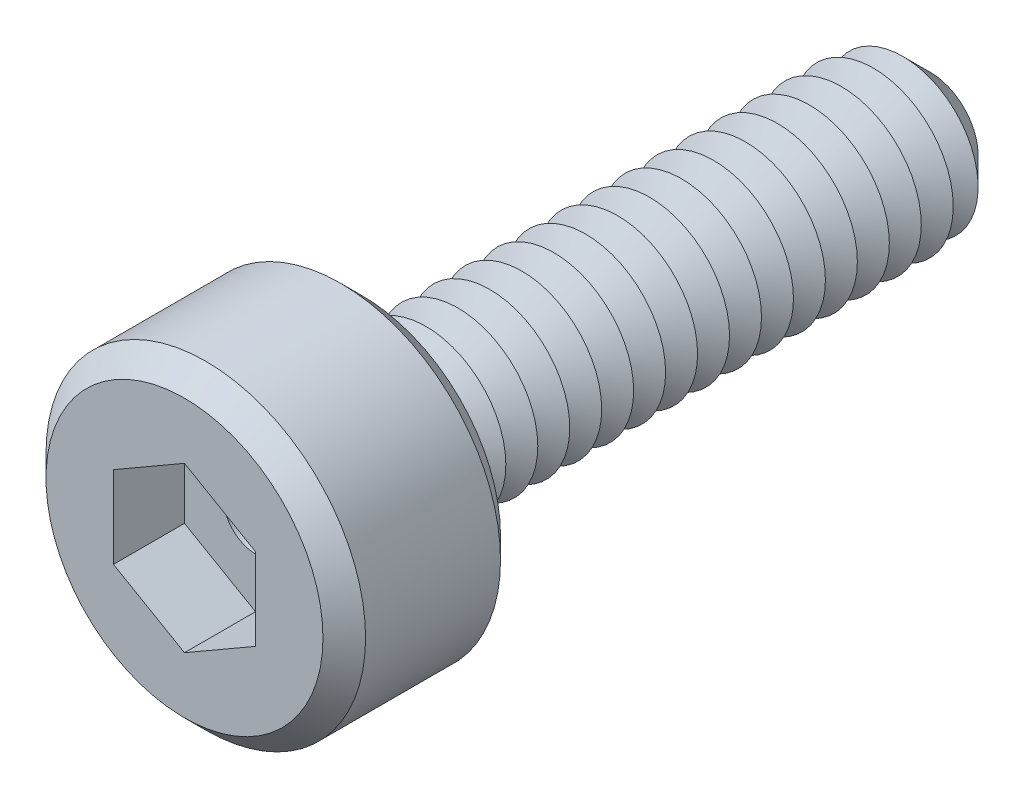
SolidWorks part; units mm, degrees
ref_plane "Front Plane" through (0, 0, 0) normal (0, 0, 1) x (1, 0, 0)
ref_plane "Top Plane" through (0, 0, 0) normal (0, 1, 0) x (1, 0, 0)
ref_plane "Right Plane" through (0, 0, 0) normal (1, 0, 0) x (0, 0, -1)
sketch "Sketch1" plane through (0, 0, 0) normal (0, 0, 1) x (1, 0, 0)
  circle A0 centre (0, 0) radius 2.25
  dimension "D1" = 4.5
extrude "Boss-Extrude1" add sketch "Sketch1" along normal blind 2.5
sketch "Sketch2" plane through (0, 0, 0) normal (0, 0, -1) x (-1, 0, 0)
  circle A0 centre (0, 0) radius 1.125
  dimension "D1" = 2.25
extrude "Boss-Extrude2" add sketch "Sketch2" along normal blind 8
chamfer "Chamfer1" distance 0.45 angle 45 1 edges at (-1.125, 0, -8)
sketch "Sketch3" plane through (0, 0, 0) normal (1, 0, 0) x (0, 0, -1)
  line L0 (-2.5121, 0) -> (4.5776, 0) construction
sketch "Sketch4" plane through (0, 0, 0) normal (1, 0, 0) x (0, 0, -1)
  line L0 (0, 1.125) -> (0.225, 0.7353)
  line L1 (0.225, 0.7353) -> (0.45, 1.125)
  line L2 (7.55, 1.125) -> (0, 1.125) construction
  line L3 (0.45, 1.125) -> (0, 1.125)
  dimension "D1" = 0.45
revolve "Cut-Revolve1" cut sketch "Sketch4" angle 360 about L0
pattern_linear "LPattern1" count 17 spacing 0.45 along (0, 0, -1) of "Cut-Revolve1"
sketch "Sketch5" plane through (0, 0, 2.5) normal (0, 0, 1) x (1, 0, 0)
  line L1 (0, 1.1547) -> (-1, 0.5774)
  line L2 (-1, 0.5774) -> (-1, -0.5774)
  line L3 (-1, -0.5774) -> (0, -1.1547)
  line L4 (0, -1.1547) -> (1, -0.5774)
  line L5 (1, -0.5774) -> (1, 0.5774)
  line L6 (1, 0.5774) -> (0, 1.1547)
  circle A0 centre (0, 0) radius 1 construction
  dimension "D1" = 2
extrude "Cut-Extrude1" cut sketch "Sketch5" against normal blind 1
sketch "Sketch6" plane through (0, 0, 1.5) normal (0, 0, 1) x (1, 0, 0)
  circle A0 centre (0, 0) radius 0.45
  dimension "D1" = 0.9
extrude "Cut-Extrude2" cut sketch "Sketch6" against normal up to surface (9.5 mm away)
chamfer "Chamfer2" distance 0.3 angle 45 2 edges at (2.25, 0, 0) (2.25, 0, 2.5)
